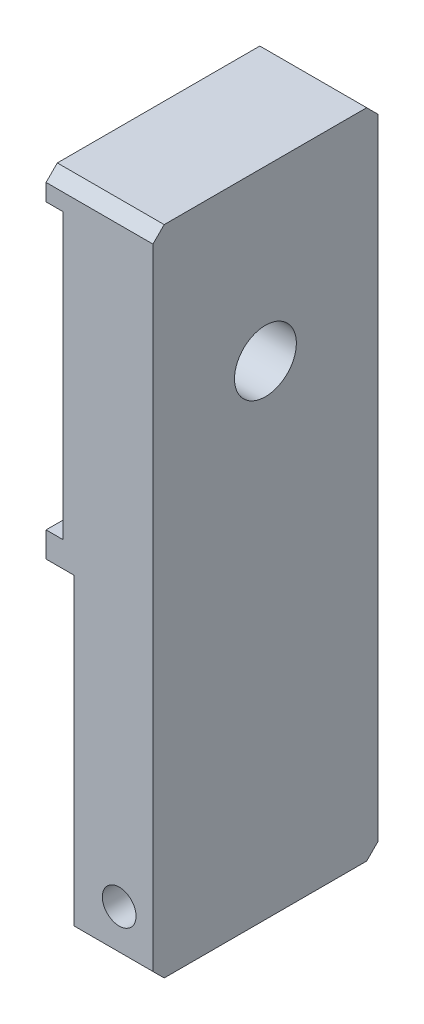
SolidWorks part; units mm, degrees
ref_plane "Face" through (0, 0, 0) normal (0, 0, 1) x (1, 0, 0)
ref_plane "Dessus" through (0, 0, 0) normal (0, 1, 0) x (1, 0, 0)
ref_plane "Droite" through (0, 0, 0) normal (1, 0, 0) x (0, 0, -1)
sketch "Esquisse1" plane through (0, 0, 0) normal (0, 0, 1) x (1, 0, 0)
  line L0 (0, 0) -> (0, 56)
  line L1 (0, 56) -> (-5, 56)
  line L2 (-5, 56) -> (-5, 60.5)
  line L3 (-5, 60.5) -> (-2, 60.5)
  line L4 (-2, 60.5) -> (-2, 111)
  line L5 (-2, 111) -> (-5, 111)
  line L6 (-5, 111) -> (-5, 116)
  line L7 (-5, 116) -> (14, 116)
  line L8 (14, 116) -> (14, 0)
  line L9 (14, 0) -> (0, 0)
  dimension "D1" = 19
  dimension "D2" = 3
  dimension "D3" = 5
  dimension "D4" = 50.5
  dimension "D5" = 56
  dimension "D6" = 116
  dimension "D7" = 14
extrude "Extrusion1" add sketch "Esquisse1" along normal mid plane 40
sketch "Esquisse2" plane through (14, 0, 0) normal (1, 0, 0) x (0, 0, -1)
  line L0 (-20, 116) -> (20, 116) construction
  line L1 (-20, 0) -> (-20, 116) construction
  circle A0 centre (0, 86) radius 5.5
  dimension "D2" = 11
  dimension "D1" = 30
  dimension "D3" = 20
extrude "Enlèv. mat.-Extru.1" cut sketch "Esquisse2" against normal up to next
sketch "Esquisse3" plane through (0, 0, 20) normal (0, 0, 1) x (1, 0, 0)
  line L0 (0, 0) -> (14, 0) construction
  line L1 (14, 0) -> (14, 116) construction
  circle A0 centre (8, 9) radius 3
  dimension "D1" = 9
  dimension "D2" = 6
  dimension "D3" = 6
extrude "Enlèv. mat.-Extru.2" cut sketch "Esquisse3" against normal up to next
chamfer "Chanfrein1" distance 2 angle 45 4 edges at (4.5, 116, 20) (4.5, 116, -20) (7, 0, -20) (7, 0, 20)
